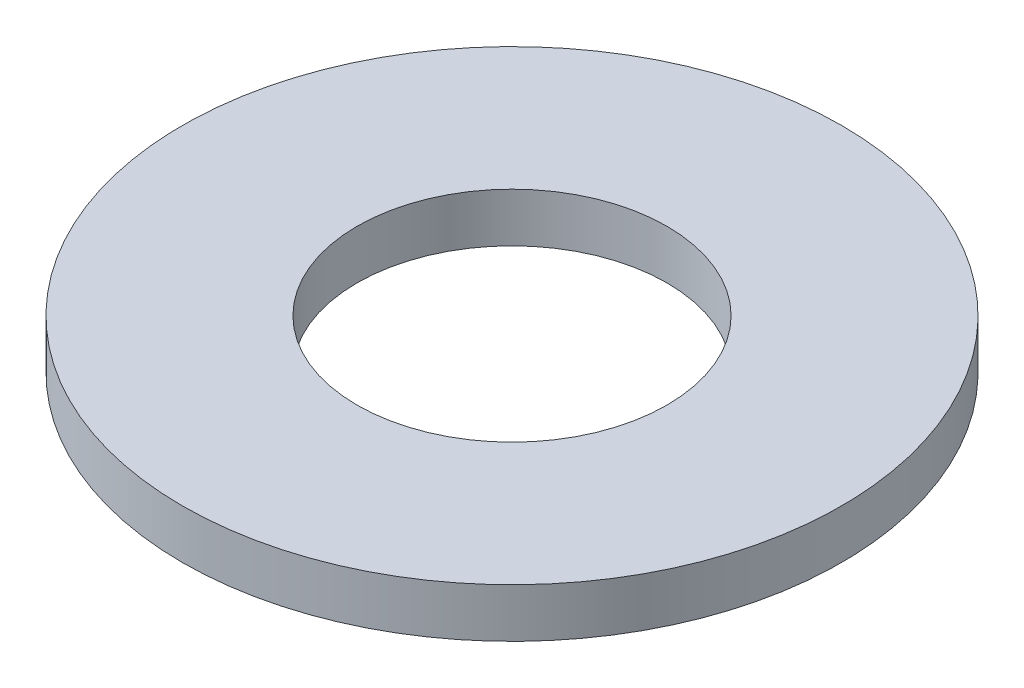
SolidWorks part; units mm, degrees
ref_plane "Front Plane" through (0, 0, 0) normal (0, 0, 1) x (1, 0, 0)
ref_plane "Top Plane" through (0, 0, 0) normal (0, 1, 0) x (1, 0, 0)
ref_plane "Right Plane" through (0, 0, 0) normal (1, 0, 0) x (0, 0, -1)
sketch "Sketch1" plane through (0, 0, 0) normal (0, 1, 0) x (1, 0, 0)
  circle A0 centre (0, 0) radius 1.85
  circle A1 centre (0, 0) radius 3.935
  dimension "D1" = 7.87
  dimension "D2" = 3.7
extrude "Boss-Extrude1" add sketch "Sketch1" along normal blind 0.586
